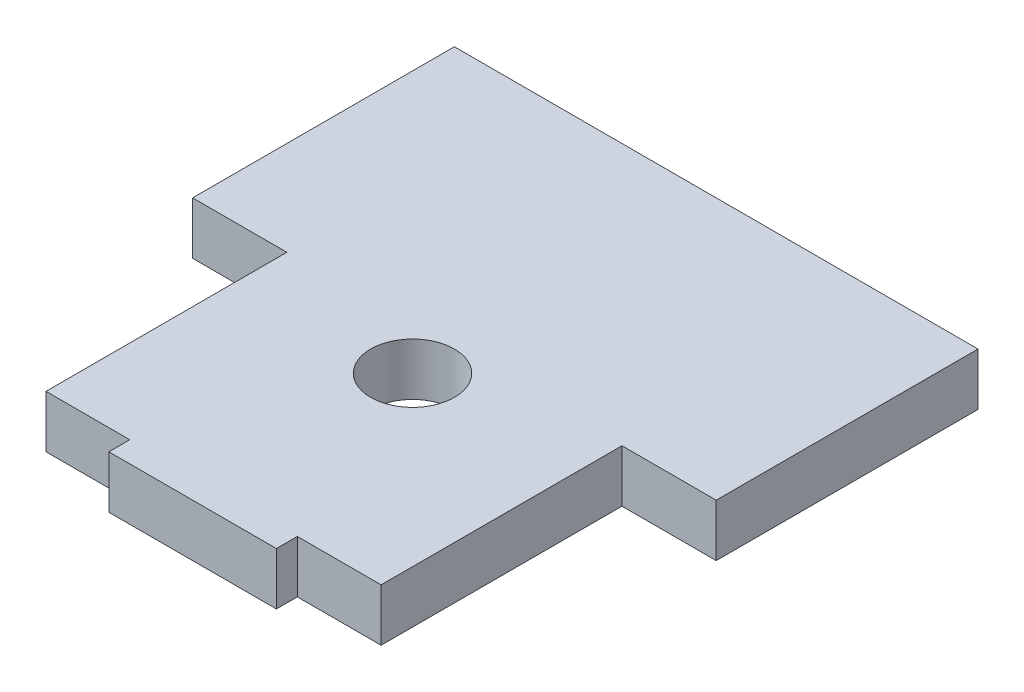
SolidWorks part; units mm, degrees
ref_plane "Front" through (0, 0, 0) normal (0, 0, 1) x (1, 0, 0)
ref_plane "Top" through (0, 0, 0) normal (0, 1, 0) x (1, 0, 0)
ref_plane "Right" through (0, 0, 0) normal (1, 0, 0) x (0, 0, -1)
sketch "Sketch1" plane through (0, 0, 0) normal (0, 1, 0) x (1, 0, 0)
  line L0 (9, 2) -> (9, 25)
  line L1 (17, 0) -> (33, 0)
  line L3 (0, 50) -> (50, 50)
  line L5 (41, 2) -> (41, 25)
  line L6 (17, 0) -> (17, 2)
  line L7 (0, 25) -> (9, 25)
  line L8 (33, 0) -> (33, 2)
  line L9 (50, 25) -> (50, 50)
  line L11 (9, 2) -> (17, 2)
  line L12 (0, 25) -> (0, 50)
  line L14 (9, 0) -> (9, 50) construction
  line L16 (41, 25) -> (50, 25)
  line L17 (17, 0) -> (17, 50) construction
  line L18 (0, 25) -> (50, 25) construction
  line L19 (33, 2) -> (41, 2)
  circle A0 centre (25, 21) radius 4
extrude "Extrude1" add sketch "Sketch1" along normal blind 5
